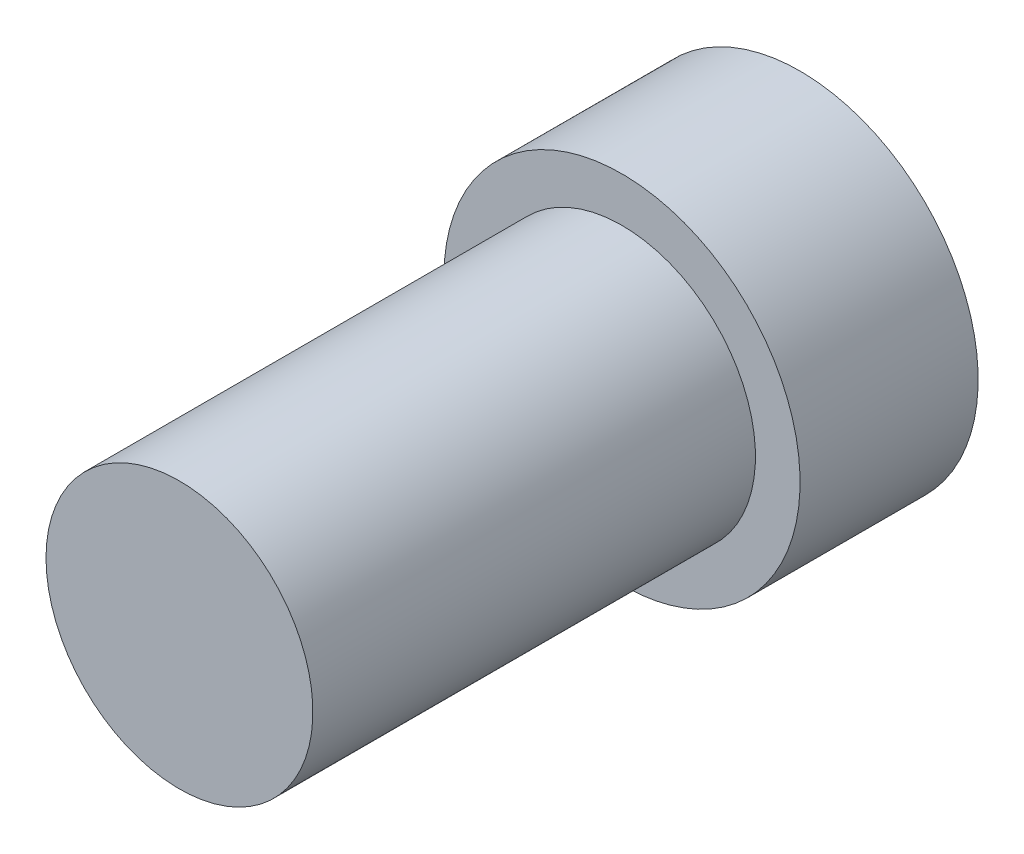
SolidWorks part; units mm, degrees
ref_plane "Front" through (0, 0, 0) normal (0, 0, 1) x (1, 0, 0)
ref_plane "Top" through (0, 0, 0) normal (0, 1, 0) x (1, 0, 0)
ref_plane "Right" through (0, 0, 0) normal (1, 0, 0) x (0, 0, -1)
sketch "Logo3_Revol_Axis" plane through (0, 0, 0) normal (0, 1, 0) x (1, 0, 0)
  line L0 (0, -43.5172) -> (0, 43.5172) construction
sketch "Logo3_bib1" plane through (0, 0, 0) normal (0, -1, 0) x (-1, 0, 0)
  line L0 (7.1374, 0) -> (9.525, 0)
  line L1 (0, 9.525) -> (0, -23.6728)
  line L2 (0, -43.5172) -> (0, 43.5172) construction
  line L3 (0, 9.525) -> (9.525, 9.525)
  line L4 (9.525, 0) -> (9.525, 9.525)
  line L7 (0, -23.6728) -> (7.1374, -23.6728)
  line L8 (7.1374, 0) -> (7.1374, -23.6728)
  line L10 (0, 16.5468) -> (0, -90.6614) construction
  dimension "logo3_head_l" = 9.525
  dimension "logo3_l1" = 33.1978
  dimension "logo3_d1" = 14.2748
  dimension "logo3_head_d" = 19.05
revolve "Revolve1" add sketch "Logo3_bib1" angle 360 about L10
